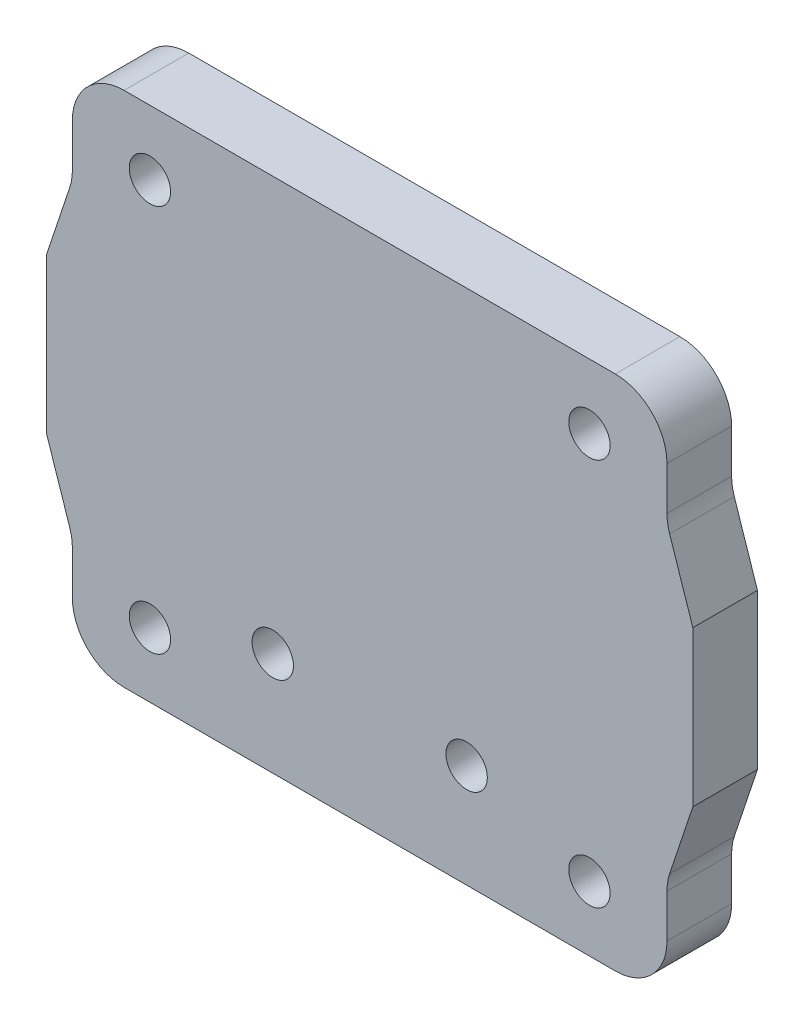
SolidWorks part; units mm, degrees
ref_plane "Piano frontale" through (0, 0, 0) normal (0, 0, 1) x (1, 0, 0)
ref_plane "Piano superiore" through (0, 0, 0) normal (0, 1, 0) x (1, 0, 0)
ref_plane "Piano destro" through (0, 0, 0) normal (1, 0, 0) x (0, 0, -1)
sketch "Schizzo1" plane through (0, 0, 0) normal (0, 0, 1) x (1, 0, 0)
  line L1 (-23, 20) -> (23, 20)
  line L2 (-23, 20) -> (-23, -20)
  line L3 (-23, -20) -> (23, -20)
  line L4 (23, 20) -> (23, -20)
  line L5 (-23, 20) -> (23, -20) construction
  line L6 (-23, -20) -> (23, 20) construction
  point P0 (0, 0)
  dimension "D1" = 46
  dimension "D2" = 40
extrude "Estrusione-Estrusione1" add sketch "Schizzo1" along normal blind 5
sketch "Schizzo2" plane through (0, 0, 5) normal (0, 0, 1) x (1, 0, 0)
  line L0 (-25, 0) -> (0, 0) construction
  line L1 (0, 0) -> (0, 20) construction
  line L2 (23, 20) -> (-23, 20) construction
  line L3 (-25, -6) -> (-25, 6)
  line L4 (-25, 6) -> (-23, 12)
  line L5 (-23, 20) -> (-23, -20) construction
  line L6 (-25, -6) -> (-23, -12)
  line L7 (-23, 12) -> (-23, -12)
  line L8 (23, 12) -> (23, -12)
  line L9 (25, -6) -> (23, -12)
  line L10 (25, 6) -> (23, 12)
  line L11 (25, -6) -> (25, 6)
  dimension "D1" = 25
  dimension "D2" = 6
  dimension "D3" = 6
extrude "Estrusione-Estrusione2" add sketch "Schizzo2" against normal blind 5
fillet "Raccordo1" radius 4 8 edges at (23, 20, 2.5) (-23, 20, 2.5) (-23, -20, 2.5) (23, -20, 2.5) (23, 12, 2.5) (23, -12, 2.5) (-23, 12, 2.5) (-23, -12, 2.5)
sketch "Schizzo3" plane through (0, 0, 5) normal (0, 0, 1) x (1, 0, 0)
  line L0 (-7.5, -12) -> (7.5, -12) construction
  line L1 (-17, 15) -> (17, 15) construction
  line L2 (-17, 15) -> (-17, -15) construction
  line L3 (-17, -15) -> (17, -15) construction
  line L4 (17, 15) -> (17, -15) construction
  line L5 (-17, 15) -> (17, -15) construction
  line L6 (-17, -15) -> (17, 15) construction
  line L7 (-20.5, 18.5) -> (20.5, 18.5) construction
  line L8 (-20.5, 18.5) -> (-20.5, -18.5) construction
  line L9 (-20.5, -18.5) -> (20.5, -18.5) construction
  line L10 (20.5, 18.5) -> (20.5, -18.5) construction
  line L11 (-20.5, 18.5) -> (20.5, -18.5) construction
  line L12 (-20.5, -18.5) -> (20.5, 18.5) construction
  line L13 (-19, -20) -> (19, -20) construction
  circle A0 centre (-17, 15) radius 1.6
  circle A1 centre (17, 15) radius 1.6
  circle A2 centre (17, -15) radius 1.6
  circle A3 centre (-17, -15) radius 1.6
  circle A4 centre (-7.5, -12) radius 1.6
  circle A5 centre (7.5, -12) radius 1.6
  point P0 (0, 0)
  point P10 (0, 0)
  point P21 (0, -12)
  dimension "D3" = 3.2
  dimension "D1" = 34
  dimension "D2" = 30
  dimension "D4" = 41
  dimension "D5" = 37
  dimension "D6" = 15
  dimension "D7" = 8
extrude "Taglio-Estrusione1" cut sketch "Schizzo3" against normal through all
